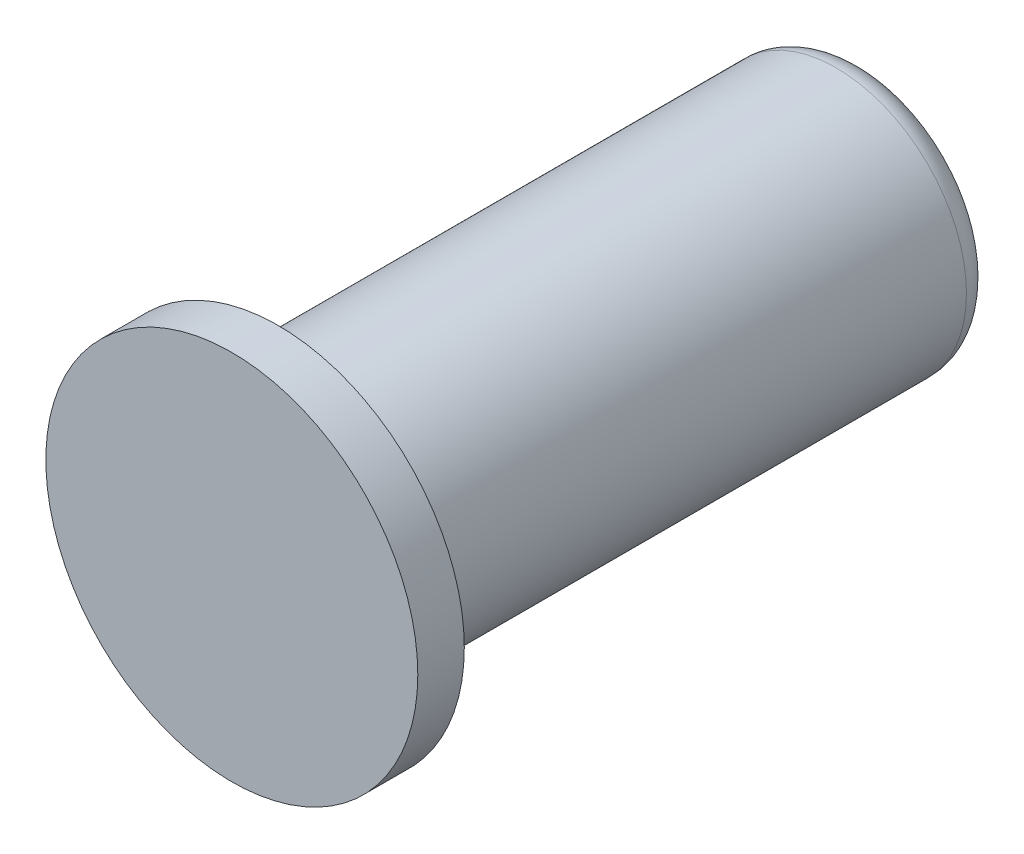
SolidWorks part; units mm, degrees
ref_plane "Front Plane" through (0, 0, 0) normal (0, 0, 1) x (1, 0, 0)
ref_plane "Top Plane" through (0, 0, 0) normal (0, 1, 0) x (1, 0, 0)
ref_plane "Right Plane" through (0, 0, 0) normal (1, 0, 0) x (0, 0, -1)
sketch "Sketch1" plane through (0, 0, 0) normal (1, 0, 0) x (0, 0, -1)
  line L0 (0, 0) -> (28, 0) construction
  line L1 (0, 0) -> (0, 20)
  line L2 (0, 20) -> (5, 20)
  line L3 (5, 20) -> (5, 14)
  line L4 (5, 14) -> (65, 14)
  line L5 (68, 11) -> (68, 3.5)
  line L6 (67.5, 3) -> (59, 3)
  line L7 (59, 3) -> (57.2679, 0)
  line L8 (68, 3.5) -> (67.5, 3)
  line L9 (0, 0) -> (57.2679, 0)
  arc A0 (65, 14) -> (68, 11) centre (65, 11) cw
  dimension "D4" = 3
  dimension "D1" = 14
  dimension "D2" = 20
  dimension "D3" = 5
  dimension "D5" = 9
  dimension "D6" = 3
  dimension "D7" = 60
  dimension "D8" = 63
  dimension "D9" = 45
  dimension "D10" = 0.5
revolve "Revolve1" add sketch "Sketch1" angle 360 about L0
